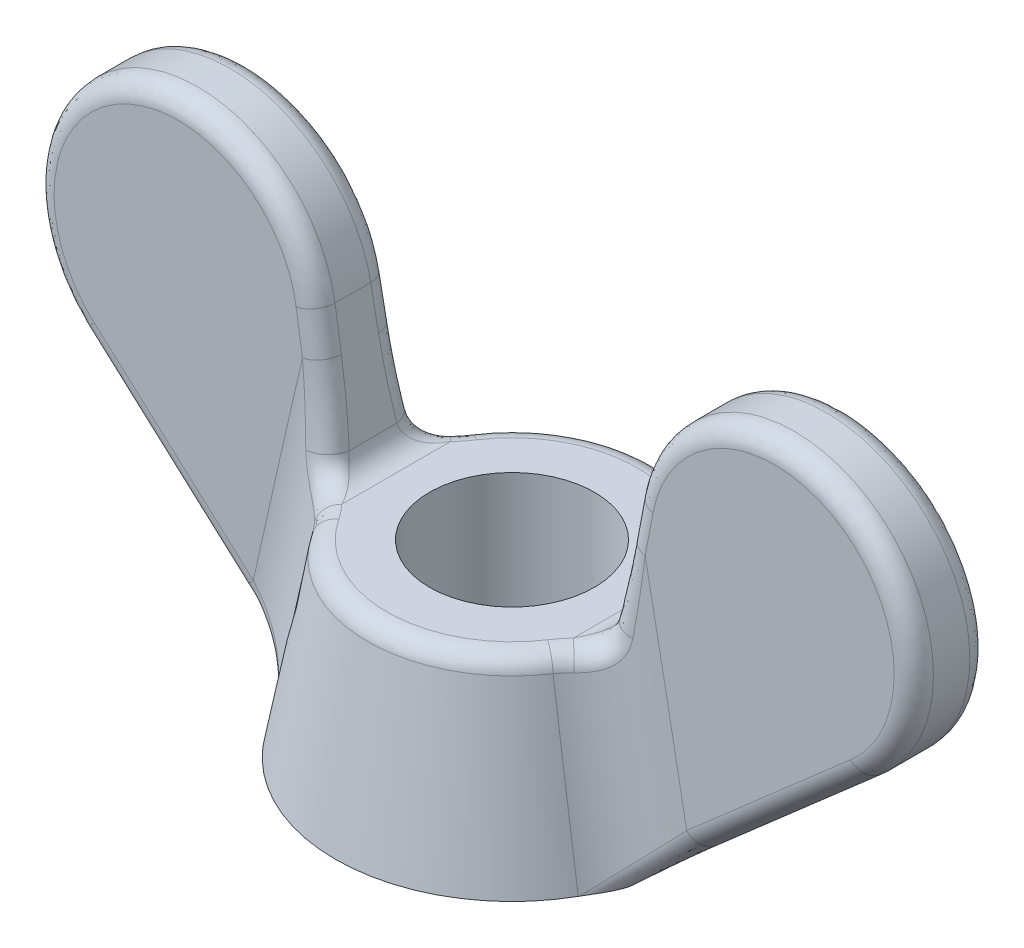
SolidWorks part; units mm, degrees
ref_plane "Front Plane" through (0, 0, 0) normal (0, 0, 1) x (1, 0, 0)
ref_plane "Top Plane" through (0, 0, 0) normal (0, 1, 0) x (1, 0, 0)
ref_plane "Right Plane" through (0, 0, 0) normal (1, 0, 0) x (0, 0, -1)
other "Configuration Table"
sketch "BaseNutSke" plane through (0, 0, 0) normal (0, 0, 1) x (1, 0, 0)
  line L0 (0, 0) -> (-22.5, 0)
  line L1 (-22.5, 0) -> (-18, 24)
  line L2 (-18, 24) -> (0, 24)
  line L3 (0, 24) -> (0, 0)
  line L4 (0, -38.5148) -> (0, 38.5148) construction
revolve "BaseNut" add sketch "BaseNutSke" angle 360 about L4
sketch "BaseWingSke" plane through (0, 0, 0) normal (1, 0, 0) x (0, 0, -1)
  line L0 (0, 0) -> (0, 62.8635) construction
  line L1 (-4.5, 56) -> (-5.5, 0)
  line L2 (-4.5, 56) -> (4.5, 56)
  line L3 (4.5, 56) -> (5.5, 0)
  line L4 (5.5, 0) -> (-5.5, 0)
  point P8 (0, 56)
  dimension "TopWing_Width" = 9
  dimension "BottomWing_Width" = 11
  dimension "Height" = 56
extrude "BaseWing" add sketch "BaseWingSke" along normal mid plane 112
sketch "CutWingSke" plane through (0, 0, 0) normal (0, 0, 1) x (1, 0, 0)
  line L0 (0, 0) -> (0, 84.5075) construction
  line L1 (-21.8174, 0) -> (-49.8318, 24.435)
  line L2 (-17.2708, 24) -> (-20.2704, 41.1085)
  line L3 (56, 56) -> (-56, 56) construction
  line L4 (-56, 56) -> (-56, 0) construction
  line L5 (-17.2708, 24) -> (17.2708, 24)
  line L6 (-21.8174, 0) -> (21.8174, 0)
  line L7 (21.8174, 0) -> (49.8318, 24.435)
  line L8 (17.2708, 24) -> (20.2704, 41.1085)
  line L9 (-21.8174, 0) -> (-56, 0) construction
  line L10 (-66, 66) -> (66, 66)
  line L11 (-66, 66) -> (-66, -10)
  line L12 (-66, -10) -> (66, -10)
  line L13 (66, 66) -> (66, -10)
  line L14 (56, 56) -> (56, 0) construction
  arc A0 (-20.2704, 41.1085) -> (-49.8318, 24.435) centre (-38, 38) ccw
  arc A1 (20.2704, 41.1085) -> (49.8318, 24.435) centre (38, 38) cw
  dimension "Radius1" = 18
  dimension "D1" = 10
  dimension "D2" = 10
  dimension "D3" = 10
  dimension "D4" = 10
extrude "CutWing" cut sketch "CutWingSke" against normal mid plane 112
sketch "HoleSke" plane through (0, 24, 0) normal (0, 1, 0) x (1, 0, 0)
  circle A0 centre (0, 0) radius 10.5
extrude "TappedHole" cut sketch "HoleSke" against normal through all
chamfer "Chamfer1" distance 1.4 angle 60 1 edges at (0, 0, 10.5)
sketch "ThdSchSke" plane through (0, 0, 0) normal (0, 0, 1) x (1, 0, 0)
  line L0 (10.5, 1.4) -> (8.7679, 1.4)
  line L1 (8.7679, 1.4) -> (8.7679, 3.1321)
  line L2 (8.7679, 3.1321) -> (10.5, 3.1321)
  line L3 (10.5, 3.1321) -> (12, 2.266)
  line L4 (12, 2.266) -> (10.5, 1.4)
  line L5 (0, -3.4614) -> (0, 8.4929) construction
  line L6 (-10.5, 1.4) -> (10.5, 1.4) construction
revolve "ThreadSchematic" [suppressed] cut sketch "ThdSchSke" angle 360 about L5
pattern_linear "ThdSchPat" [suppressed]
fillet "Fillet1" radius 3 2 edges at (-17.2708, 24, 0) (17.2708, 24, 0)
fillet "Fillet2" radius 11 4 edges
fillet "Fillet3" radius 2.5 30 edges at (-24.7832, 2.5869, 6.1834) (24.0549, 1.9516, 6.5591) (39.0108, 14.9966, 5.2322) (47.1974, 53.4728, 4.5451) (17.0204, 25.0379, 7.5169) (0, 24, 18) (0, 24, -18) (-16.901, 24.9077, 7.6387) (24.7832, 2.5869, -6.1834) (39.0108, 14.9966, -5.2322) (47.1974, 53.4728, -4.5451) (16.901, 24.9077, -7.6387) (-17.0204, 25.0379, -7.5169) (-24.0549, 1.9516, -6.5591) (-39.0108, 14.9966, -5.2322) (-47.1974, 53.4728, 4.5451) (-39.0108, 14.9966, 5.2322) (-47.1974, 53.4728, -4.5451)
equation "\"D1@CutWing\" = \"Width@BaseWing\""
equation "\"D1@Chamfer1\" = \"Tap_drill@HoleSke\"/15"
equation "\"D1@ThdSchSke\" = \"Tap_drill@HoleSke\""
equation "\"ThreadN@ThdSchSke\" = \"Thread_major@ThreadCosmetic\""
equation "\"Num_threads@ThdSchPat\" = int( \"Nut_Height@BaseNutSke\"/\"Advance@ThdSchPat\" ) +1"
